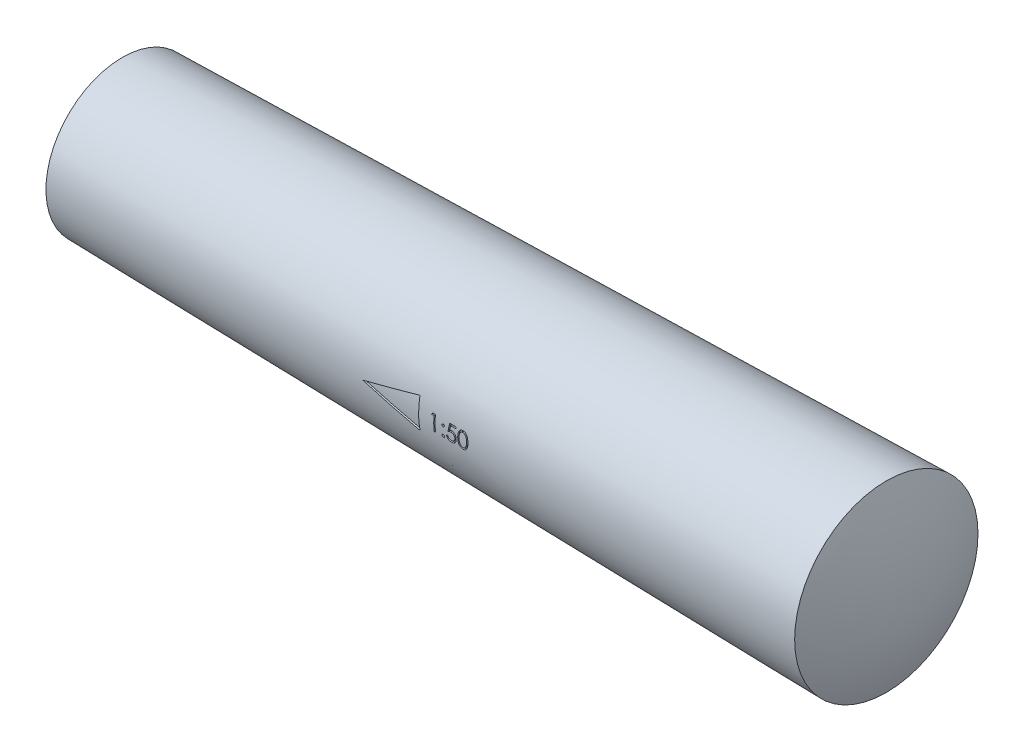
SolidWorks part; units mm, degrees
ref_plane "Front Plane" through (0, 0, 0) normal (0, 0, 1) x (1, 0, 0)
ref_plane "Top Plane" through (0, 0, 0) normal (0, 1, 0) x (1, 0, 0)
ref_plane "Right Plane" through (0, 0, 0) normal (1, 0, 0) x (0, 0, -1)
sketch "Sketch1" plane through (0, 0, 0) normal (1, 0, 0) x (0, 0, -1)
  circle A0 centre (0, 0) radius 5
  dimension "D1" = 10
extrude "Extrude1" add sketch "Sketch1" along normal mid plane 50
draft "Draft1" type of draft neutral plane draft angle 1.146 faces to draft 1 parameters "D1"=1.146
sketch "Sketch2" plane through (0, 0, 0) normal (0, 0, 1) x (1, 0, 0)
  line L0 (-25, 0) -> (-25, 5)
  line L1 (-25, 5) -> (-25, -5) construction
  line L2 (-25, 0) -> (-26.2, 0)
  line L3 (-26.2, 0) -> (-26.2, -5.5) construction
  line L4 (25, 0) -> (25, 6)
  line L5 (25, -6) -> (25, 6) construction
  line L6 (25, 0) -> (26.2, 0)
  line L7 (26.2, 0) -> (26.2, -5.5) construction
  line L8 (-25, -5) -> (25, -6) construction
  arc A0 (-26.2, 0) -> (-25, 5) centre (-15.1833, 0) cw
  arc A1 (26.2, 0) -> (25, 6) centre (10.5998, 0) ccw
  point P14 (0, -5.5)
revolve "Revolve1" add sketch "Sketch2" angle 360 about L2
sketch "Sketch5" plane through (0, 0, 0) normal (0, 0, 1) x (1, 0, 0)
  line L0 (0, 5.5) -> (0, -5.5) construction
  line L1 (25, 6) -> (-25, 5) construction
  line L2 (-25, -5) -> (25, -6) construction
ref_plane "Plane2" through (0, 0, 0) normal (-0.02, 0, 0.9998) x (0.9998, 0, 0.02)
sketch "Sketch6" plane through (0, 0, 0) normal (-0.02, 0, 0.9998) x (0.9998, 0, 0.02)
  line L0 (0, 0) -> (0, 1)
  line L1 (0, 5.5) -> (0, -5.5) construction
  line L2 (0, 1) -> (-3.7321, 0)
  line L3 (-3.7321, 0) -> (0, -1)
  line L4 (0, -1) -> (0, 0)
  line L5 (0, -0.5) -> (4, -0.5) construction
  text T0 "1:50" font "Century Gothic" height 1
  dimension "D1" = 2
  dimension "D2" = 30
  dimension "D3" = 4
wrap "Wrap2" sketch "Sketch6" wrap type deboss source sketch "Sketch6" thickness 0.1 parameters "D1"=0.1
equation "\"D2@Sketch2\" = \"D1@Sketch2\""
